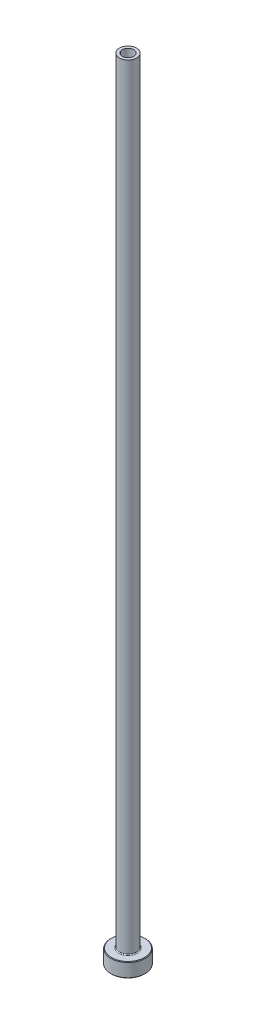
SolidWorks part; units mm, degrees
ref_plane "Front Plane" through (0, 0, 0) normal (0, 0, 1) x (1, 0, 0)
ref_plane "Top Plane" through (0, 0, 0) normal (0, 1, 0) x (1, 0, 0)
ref_plane "Right Plane" through (0, 0, 0) normal (1, 0, 0) x (0, 0, -1)
sketch "Sketch1" plane through (0, 0, 0) normal (0, 0, 1) x (1, 0, 0)
  line L0 (-2, 275) -> (-3, 275)
  line L1 (-3, 275) -> (-3, 5)
  line L2 (-3, 5) -> (-6, 5)
  line L3 (-6, 5) -> (-6, 0)
  line L4 (6.6, 0) -> (-6.6, 0) construction
  line L5 (-6, 0) -> (-2.25, 0)
  line L6 (-2, 230) -> (-2, 275)
  line L7 (0, 92.1877) -> (0, -15.5353) construction
  line L8 (0, -6.6) -> (0, 6.6) construction
  line L9 (-2, 230) -> (-2.25, 218)
  line L10 (-2.25, 218) -> (-2.25, 0)
  dimension "D1" = 0.25
  dimension "ID" = 4
  dimension "OD" = 6
  dimension "L" = 275
  dimension "H" = 12
  dimension "T" = 5
  dimension "N" = 45
  dimension "D2" = 12
revolve "Revolve1" add sketch "Sketch1" angle 360 about L7
fillet "Fillet1" radius 0.3 1 edges at (0, 5, 3)
chamfer "Chamfer1" distance 0.2 angle 45 2 edges at (0, 5, 6) (0, 0, 6)
chamfer "Chamfer3" distance 0.5 angle 45 1 edges at (0, 0, 2.25)
